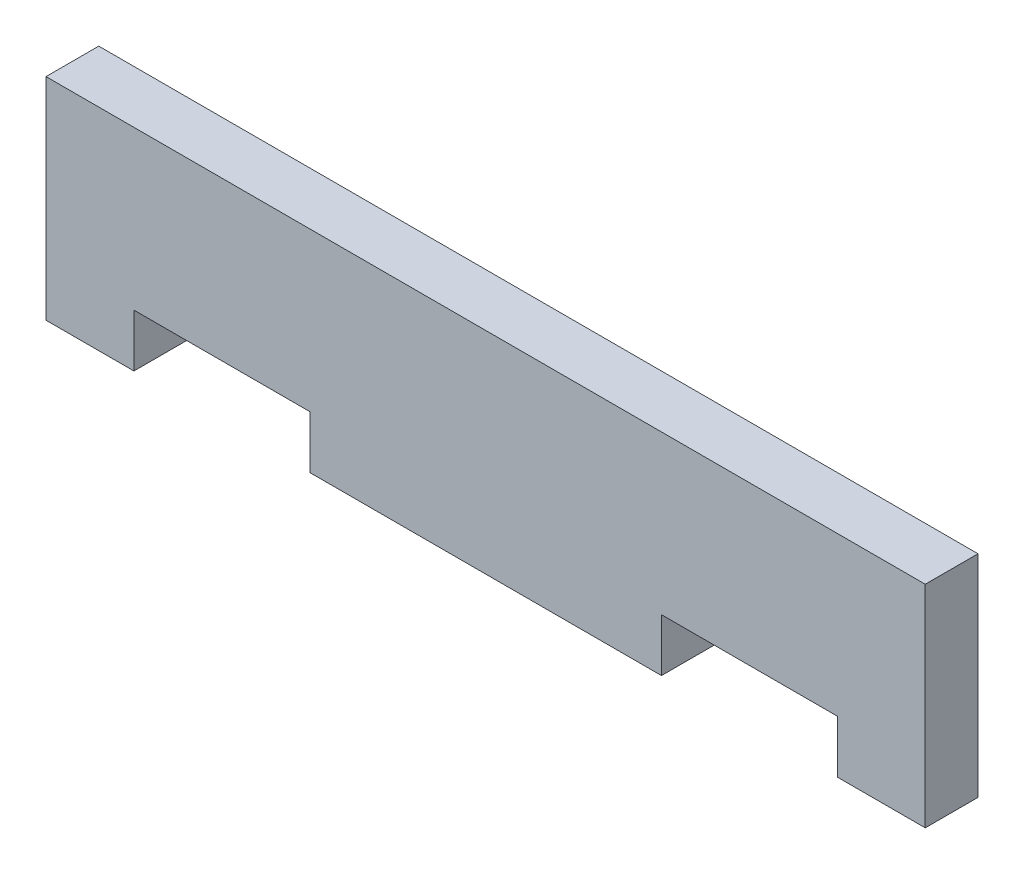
SolidWorks part; units mm, degrees
ref_plane "Plan de face" through (0, 0, 0) normal (0, 0, 1) x (1, 0, 0)
ref_plane "Plan de dessus" through (0, 0, 0) normal (0, 1, 0) x (1, 0, 0)
ref_plane "Plan de droite" through (0, 0, 0) normal (1, 0, 0) x (0, 0, -1)
sketch "Esquisse1" plane through (0, 0, 0) normal (0, 0, 1) x (1, 0, 0)
  line L1 (0, 0) -> (50, 0)
  line L2 (0, 0) -> (0, 12)
  line L3 (0, 12) -> (50, 12)
  line L4 (50, 0) -> (50, 12)
  dimension "D1" = 50
  dimension "D2" = 12
extrude "Boss.-Extru.1" add sketch "Esquisse1" along normal blind 3
sketch "Esquisse2" plane through (0, 0, 3) normal (0, 0, 1) x (1, 0, 0)
  line L0 (0, 0) -> (50, 0) construction
  line L1 (5, 0) -> (15, 0)
  line L2 (5, 0) -> (5, 3)
  line L3 (5, 3) -> (15, 3)
  line L4 (15, 0) -> (15, 3)
  line L5 (0, 12) -> (0, 0) construction
  point P6 (5, 1.5)
  dimension "D1" = 3
  dimension "D2" = 10
  dimension "D3" = 5
extrude "Enlèv. mat.-Extru.1" cut sketch "Esquisse2" against normal through all
ref_plane "Plan1" through (25, 0, 0) normal (1, 0, 0) x (0, 0, -1)
mirror "Symétrie1" about plane through (25, 0, 0) normal (1, 0, 0) of "Enlèv. mat.-Extru.1"
